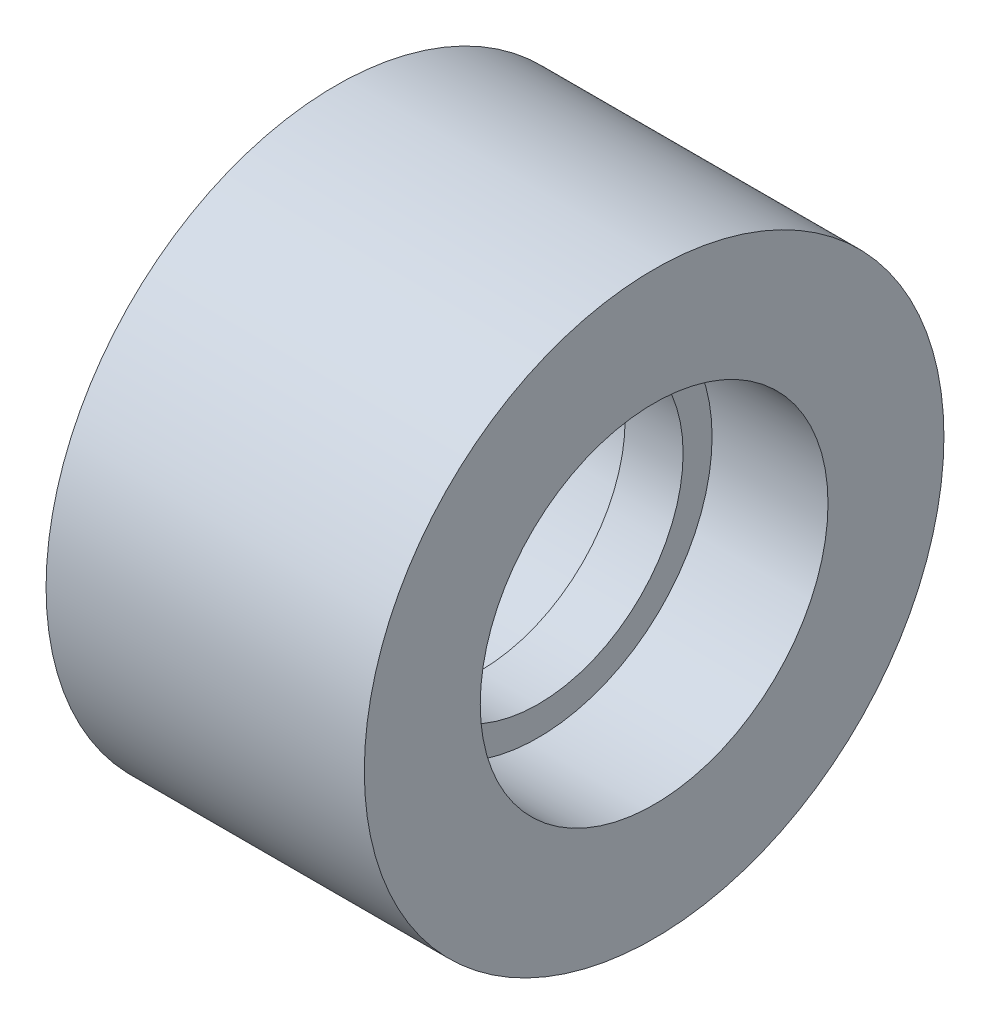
SolidWorks part; units mm, degrees
ref_plane "Plan de face" through (0, 0, 0) normal (0, 0, 1) x (1, 0, 0)
ref_plane "Plan de dessus" through (0, 0, 0) normal (0, 1, 0) x (1, 0, 0)
ref_plane "Plan de droite" through (0, 0, 0) normal (1, 0, 0) x (0, 0, -1)
sketch "Esquisse1" plane through (0, 0, 0) normal (0, 0, 1) x (1, 0, 0)
  line L0 (-17.9482, 0) -> (30.3974, 0) construction
  line L1 (0, 0) -> (0, 3.6)
  line L2 (0, 3.6) -> (0.5096, 5)
  line L3 (0.5096, 5) -> (6, 5)
  line L4 (6, 5) -> (6, 3)
  line L5 (6, 3) -> (4, 3)
  line L6 (4, 3) -> (4, 2.5)
  line L7 (4, 2.5) -> (3, 2.5)
  line L8 (3, 2.5) -> (3, 3)
  line L9 (3, 3) -> (1, 3)
  line L10 (1, 3) -> (1, 0)
  line L11 (1, 0) -> (0, 0)
  dimension "D1" = 3
  dimension "D2" = 0.5
  dimension "D3" = 2
  dimension "D4" = 6
  dimension "D5" = 1
  dimension "D6" = 3
  dimension "D7" = 1
  dimension "D8" = 0.5
  dimension "D9" = 5
  dimension "D10" = 3.6
  dimension "D11" = 20
revolve "Révolution1" add sketch "Esquisse1" angle 360 about L0
